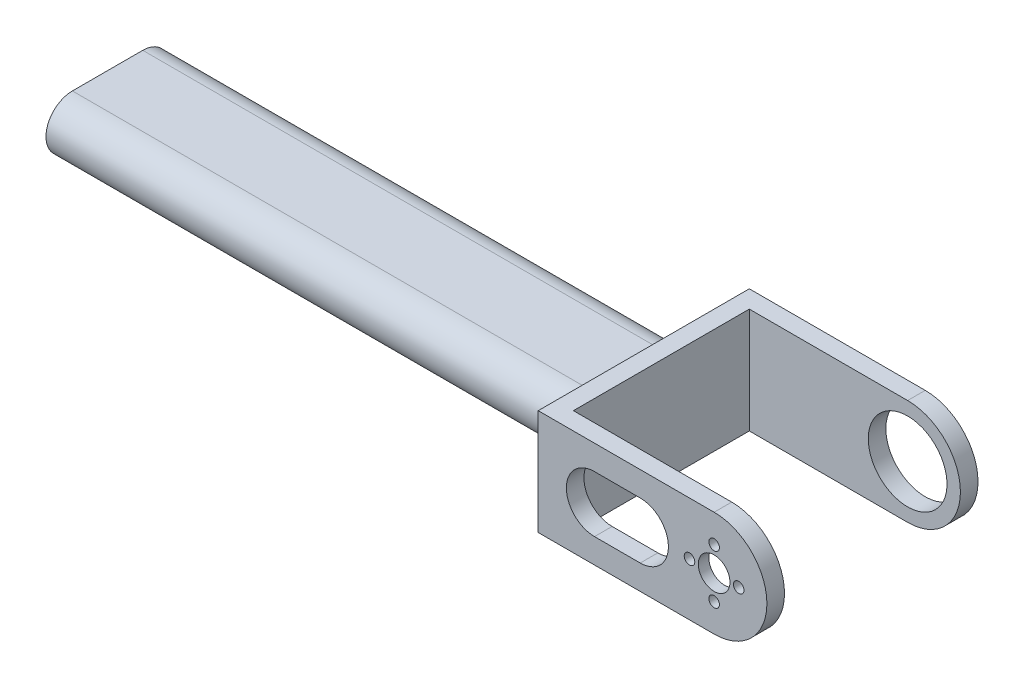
SolidWorks part; units mm, degrees
ref_plane "Front Plane" through (0, 0, 0) normal (0, 0, 1) x (1, 0, 0)
ref_plane "Top Plane" through (0, 0, 0) normal (0, 1, 0) x (1, 0, 0)
ref_plane "Right Plane" through (0, 0, 0) normal (1, 0, 0) x (0, 0, -1)
sketch "Sketch1" plane through (0, 0, 0) normal (0, 0, 1) x (1, 0, 0)
  line L3 (0, 15) -> (-50, 15)
  line L4 (-50, 15) -> (-50, -15)
  line L5 (-50, -15) -> (0, -15)
  line L6 (0, 15) -> (0, -15) construction
  line L7 (15, 0) -> (-50, 0) construction
  arc A2 (0, -15) -> (0, 15) centre (0, 0) ccw
  circle A3 centre (0, 0) radius 4.5
  circle A4 centre (0, 7) radius 1.5
  circle A5 centre (7, 0) radius 1.5
  circle A6 centre (0, -7) radius 1.5
  circle A7 centre (-7, 0) radius 1.5
  point P20 (0, 0)
  dimension "D1" = 30
  dimension "D5" = 14
  dimension "D3" = 9
  dimension "D4" = 3
  dimension "D2" = 50
  dimension "D6" = 4
extrude "Boss-Extrude1" add sketch "Sketch1" along normal blind 5
sketch "Sketch2" plane through (0, 0, 0) normal (0, 0, -1) x (-1, 0, 0)
  line L0 (50, -15) -> (0, -15) construction
  line L1 (50, 15) -> (45, 15)
  line L2 (50, 15) -> (50, -15)
  line L3 (50, -15) -> (45, -15)
  line L4 (45, 15) -> (45, -15)
  dimension "D1" = 5
extrude "Boss-Extrude2" add sketch "Sketch2" along normal blind 55
ref_plane "Plane1" through (0, 0, -25) normal (0, 0, -1) x (-1, 0, 0)
mirror "Mirror1" about plane through (0, 0, -25) normal (0, 0, -1) of "Boss-Extrude1"
sketch "Sketch4" plane through (0, 0, 0) normal (0, 0, -1) x (-1, 0, 0)
  circle A0 centre (0, 0) radius 10.19
  dimension "D1" = 20.38
extrude "Cut-Extrude1" cut sketch "Sketch4" against normal blind 2
sketch "Sketch5" plane through (0, 0, 5) normal (0, 0, 1) x (1, 0, 0)
  line L0 (-34, 0) -> (-21, 0) construction
  line L1 (-34, 8) -> (-21, 8)
  line L2 (-34, -8) -> (-21, -8)
  line L3 (0, 15) -> (-50, 15) construction
  line L5 (-50, 15) -> (-50, -15) construction
  arc A0 (-34, 8) -> (-34, -8) centre (-34, 0) ccw
  arc A1 (-21, -8) -> (-21, 8) centre (-21, 0) ccw
  point P3 (-27.5, 0)
  dimension "D3" = 22.5
  dimension "D1" = 13
  dimension "D2" = 7
extrude "Cut-Extrude2" cut sketch "Sketch5" against normal up to next
sketch "Sketch8" plane through (0, 0, -55) normal (0, 0, -1) x (-1, 0, 0)
  circle A0 centre (0, 0) radius 11.19
  dimension "D1" = 22.38
extrude "Cut-Extrude5" cut sketch "Sketch8" against normal up to next
sketch "Sketch9" plane through (-50, 0, 0) normal (-1, 0, 0) x (0, 0, 1)
  line L0 (-35, 0) -> (-15, 0) construction
  line L1 (-35, 7.5) -> (-15, 7.5)
  line L2 (-35, -7.5) -> (-15, -7.5)
  line L4 (5, 15) -> (-55, 15) construction
  arc A0 (-35, 7.5) -> (-35, -7.5) centre (-35, 0) ccw
  arc A1 (-15, -7.5) -> (-15, 7.5) centre (-15, 0) ccw
  point P2 (-25, 0)
  point P10 (-25, 15)
  dimension "D1" = 20
  dimension "D2" = 15
extrude "Boss-Extrude3" add sketch "Sketch9" along normal blind 152.4
sketch "Sketch10" plane through (-202.4, 0, 0) normal (-1, 0, 0) x (0, 0, 1)
  line L0 (-25, 7.5) -> (-25, -7.5) construction
  line L1 (-15, 7.5) -> (-35, 7.5) construction
  line L2 (-35, -7.5) -> (-15, -7.5) construction
  line L3 (-42.5, 0) -> (-7.5, 0) construction
  line L5 (-29, -4) -> (-21, -4)
  line L6 (-29, -4) -> (-29, 4)
  line L7 (-29, 4) -> (-21, 4)
  line L8 (-21, -4) -> (-21, 4)
  line L9 (-29, -4) -> (-21, 4) construction
  line L10 (-29, 4) -> (-21, -4) construction
  arc A0 (-35, 7.5) -> (-35, -7.5) centre (-35, 0) ccw construction
  arc A1 (-15, -7.5) -> (-15, 7.5) centre (-15, 0) ccw construction
  point P14 (-25, 0)
  dimension "D1" = 8
  dimension "D2" = 8
extrude "Cut-Extrude6" cut sketch "Sketch10" against normal blind 10
